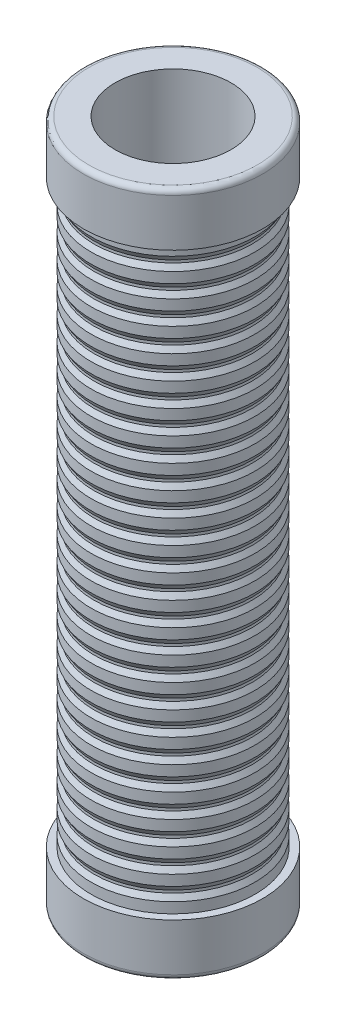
SolidWorks part; units mm, degrees
ref_plane "Front Plane" through (0, 0, 0) normal (0, 0, 1) x (1, 0, 0)
ref_plane "Top Plane" through (0, 0, 0) normal (0, 1, 0) x (1, 0, 0)
ref_plane "Right Plane" through (0, 0, 0) normal (1, 0, 0) x (0, 0, -1)
sketch "Sketch1" plane through (0, 0, 0) normal (0, 1, 0) x (1, 0, 0)
  circle A0 centre (0, 0) radius 11
  circle A1 centre (0, 0) radius 15
  dimension "D1" = 22
  dimension "D2" = 30
extrude "Boss-Extrude1" add sketch "Sketch1" along normal blind 130
ref_plane "Plane1" through (0, 65, 0) normal (0, 1, 0) x (-1, 0, 0)
sketch "Sketch3" plane through (0, 0, 0) normal (1, 0, 0) x (0, 0, -1)
  line L0 (15, 130) -> (15.5774, 129)
  line L1 (15.5774, 129) -> (15.5774, 127)
  line L2 (15.5774, 127) -> (15, 126)
  line L3 (15, 0) -> (15, 130) construction
  line L4 (15, 0) -> (15, 130) construction
  line L5 (15, 0) -> (15, 130) construction
  line L6 (15, 0) -> (15, 130) construction
  line L7 (15, 130) -> (15, 126)
  line L8 (15, 125.5) -> (15.5774, 124.5)
  line L9 (15.5774, 124.5) -> (15.5774, 122.5)
  line L10 (15.5774, 122.5) -> (15, 121.5)
  line L11 (15, 125.5) -> (15, 121.5)
  line L12 (15, 121) -> (15.5774, 120)
  line L13 (15.5774, 120) -> (15.5774, 118)
  line L14 (15.5774, 118) -> (15, 117)
  line L15 (15, 121) -> (15, 117)
  line L16 (15, 116.5) -> (15.5774, 115.5)
  line L17 (15.5774, 115.5) -> (15.5774, 113.5)
  line L18 (15.5774, 113.5) -> (15, 112.5)
  line L19 (15, 116.5) -> (15, 112.5)
  line L20 (15, 112) -> (15.5774, 111)
  line L21 (15.5774, 111) -> (15.5774, 109)
  line L22 (15.5774, 109) -> (15, 108)
  line L23 (15, 112) -> (15, 108)
  line L24 (15, 107.5) -> (15.5774, 106.5)
  line L25 (15.5774, 106.5) -> (15.5774, 104.5)
  line L26 (15.5774, 104.5) -> (15, 103.5)
  line L27 (15, 107.5) -> (15, 103.5)
  line L28 (15, 103) -> (15.5774, 102)
  line L29 (15.5774, 102) -> (15.5774, 100)
  line L30 (15.5774, 100) -> (15, 99)
  line L31 (15, 103) -> (15, 99)
  line L32 (15, 98.5) -> (15.5774, 97.5)
  line L33 (15.5774, 97.5) -> (15.5774, 95.5)
  line L34 (15.5774, 95.5) -> (15, 94.5)
  line L35 (15, 98.5) -> (15, 94.5)
  line L36 (15, 94) -> (15.5774, 93)
  line L37 (15.5774, 93) -> (15.5774, 91)
  line L38 (15.5774, 91) -> (15, 90)
  line L39 (15, 94) -> (15, 90)
  line L40 (15, 89.5) -> (15.5774, 88.5)
  line L41 (15.5774, 88.5) -> (15.5774, 86.5)
  line L42 (15.5774, 86.5) -> (15, 85.5)
  line L43 (15, 89.5) -> (15, 85.5)
  line L44 (15, 85) -> (15.5774, 84)
  line L45 (15.5774, 84) -> (15.5774, 82)
  line L46 (15.5774, 82) -> (15, 81)
  line L47 (15, 85) -> (15, 81)
  line L48 (15, 80.5) -> (15.5774, 79.5)
  line L49 (15.5774, 79.5) -> (15.5774, 77.5)
  line L50 (15.5774, 77.5) -> (15, 76.5)
  line L51 (15, 80.5) -> (15, 76.5)
  line L52 (15, 76) -> (15.5774, 75)
  line L53 (15.5774, 75) -> (15.5774, 73)
  line L54 (15.5774, 73) -> (15, 72)
  line L55 (15, 76) -> (15, 72)
  line L56 (15, 71.5) -> (15.5774, 70.5)
  line L57 (15.5774, 70.5) -> (15.5774, 68.5)
  line L58 (15.5774, 68.5) -> (15, 67.5)
  line L59 (15, 71.5) -> (15, 67.5)
  line L60 (15, 67) -> (15.5774, 66)
  line L61 (15.5774, 66) -> (15.5774, 64)
  line L62 (15.5774, 64) -> (15, 63)
  line L63 (15, 67) -> (15, 63)
  line L64 (15, 62.5) -> (15.5774, 61.5)
  line L65 (15.5774, 61.5) -> (15.5774, 59.5)
  line L66 (15.5774, 59.5) -> (15, 58.5)
  line L67 (15, 62.5) -> (15, 58.5)
  line L68 (15, 58) -> (15.5774, 57)
  line L69 (15.5774, 57) -> (15.5774, 55)
  line L70 (15.5774, 55) -> (15, 54)
  line L71 (15, 58) -> (15, 54)
  line L72 (15, 53.5) -> (15.5774, 52.5)
  line L73 (15.5774, 52.5) -> (15.5774, 50.5)
  line L74 (15.5774, 50.5) -> (15, 49.5)
  line L75 (15, 53.5) -> (15, 49.5)
  line L76 (15, 49) -> (15.5774, 48)
  line L77 (15.5774, 48) -> (15.5774, 46)
  line L78 (15.5774, 46) -> (15, 45)
  line L79 (15, 49) -> (15, 45)
  line L80 (15, 44.5) -> (15.5774, 43.5)
  line L81 (15.5774, 43.5) -> (15.5774, 41.5)
  line L82 (15.5774, 41.5) -> (15, 40.5)
  line L83 (15, 44.5) -> (15, 40.5)
  line L84 (15, 40) -> (15.5774, 39)
  line L85 (15.5774, 39) -> (15.5774, 37)
  line L86 (15.5774, 37) -> (15, 36)
  line L87 (15, 40) -> (15, 36)
  line L88 (15, 35.5) -> (15.5774, 34.5)
  line L89 (15.5774, 34.5) -> (15.5774, 32.5)
  line L90 (15.5774, 32.5) -> (15, 31.5)
  line L91 (15, 35.5) -> (15, 31.5)
  line L92 (15, 31) -> (15.5774, 30)
  line L93 (15.5774, 30) -> (15.5774, 28)
  line L94 (15.5774, 28) -> (15, 27)
  line L95 (15, 31) -> (15, 27)
  line L96 (15, 26.5) -> (15.5774, 25.5)
  line L97 (15.5774, 25.5) -> (15.5774, 23.5)
  line L98 (15.5774, 23.5) -> (15, 22.5)
  line L99 (15, 26.5) -> (15, 22.5)
  line L100 (15, 22) -> (15.5774, 21)
  line L101 (15.5774, 21) -> (15.5774, 19)
  line L102 (15.5774, 19) -> (15, 18)
  line L103 (15, 22) -> (15, 18)
  line L104 (15, 17.5) -> (15.5774, 16.5)
  line L105 (15.5774, 16.5) -> (15.5774, 14.5)
  line L106 (15.5774, 14.5) -> (15, 13.5)
  line L107 (15, 17.5) -> (15, 13.5)
  line L108 (15, 13) -> (15.5774, 12)
  line L109 (15.5774, 12) -> (15.5774, 10)
  line L110 (15.5774, 10) -> (15, 9)
  line L111 (15, 13) -> (15, 9)
  line L112 (15, 8.5) -> (15.5774, 7.5)
  line L113 (15.5774, 7.5) -> (15.5774, 5.5)
  line L114 (15.5774, 5.5) -> (15, 4.5)
  line L115 (15, 8.5) -> (15, 4.5)
  line L116 (15, 4) -> (15.5774, 3)
  line L117 (15.5774, 3) -> (15.5774, 1)
  line L118 (15.5774, 1) -> (15, 0)
  line L119 (15, 4) -> (15, 0)
  dimension "D1" = 30
  dimension "D2" = 30
  dimension "D3" = 2
  dimension "D4" = 4
  dimension "D5" = 29
revolve "Revolve1" add sketch "Sketch3" angle 360 about L0
sketch "Sketch4" plane through (0, 0, 0) normal (0, 1, 0) x (1, 0, 0)
  circle A0 centre (0, 0) radius 17
  circle A1 centre (0, 0) radius 11
  dimension "D1" = 34
  dimension "D2" = 22
extrude "Boss-Extrude2" add sketch "Sketch4" along normal blind 10
ref_plane "Plane2" through (0, 130, 0) normal (0, 1, 0) x (-1, 0, 0)
sketch "Sketch5" plane through (0, 130, 0) normal (0, 1, 0) x (-1, 0, 0)
  circle A0 centre (0, 0) radius 11
  circle A1 centre (0, 0) radius 17
  dimension "D1" = 34
  dimension "D2" = 22
extrude "Boss-Extrude3" add sketch "Sketch5" against normal blind 10
fillet "Fillet1" radius 1 2 edges at (0, 0, 17) (0, 130, 17)
